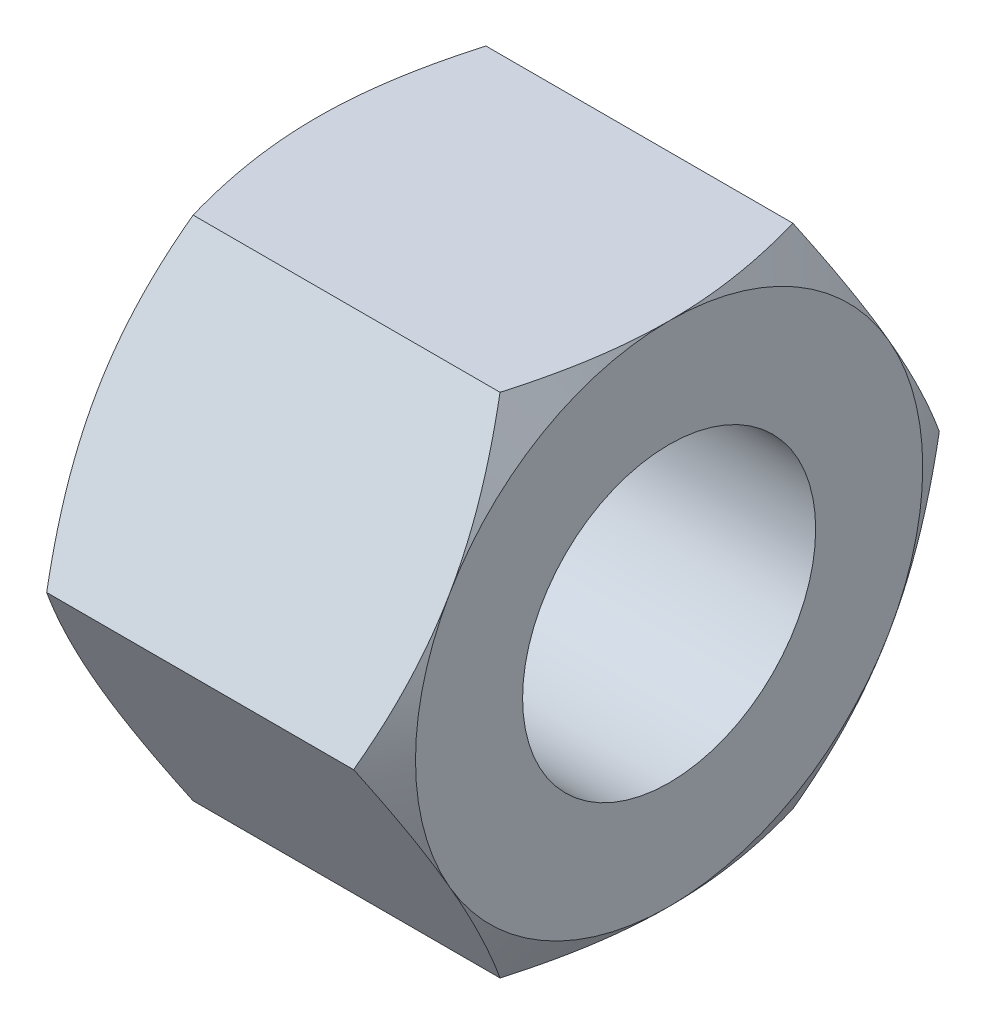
SolidWorks part; units mm, degrees
ref_plane "Plan1" through (0, 0, 0) normal (0, 0, 1) x (1, 0, 0)
ref_plane "Plan2" through (0, 0, 0) normal (0, 1, 0) x (1, 0, 0)
ref_plane "Plan3" through (0, 0, 0) normal (1, 0, 0) x (0, 0, -1)
sketch "Contour" plane through (0, 0, 0) normal (0, 0, 1) x (1, 0, 0)
  line L0 (-30, 0) -> (17.994, 0) construction
  line L1 (0, 10.4) -> (-25, 10.4)
  line L2 (0, 18) -> (-1.608, 20.7852)
  line L3 (0, 10.4) -> (0, 18)
  line L4 (-1.608, 20.7852) -> (-23.392, 20.7852)
  line L5 (-25, 18) -> (-25, 10.4)
  line L7 (-23.392, 20.7852) -> (-25, 18)
  dimension "D2" = 60
  dimension "d" = 20.8
  dimension "k" = 25
  dimension "D1" = 60
  dimension "s" = 36
  dimension "Dt" = 41.5704
revolve "Base-Révolution" add sketch "Contour" angle 360 about L0
sketch "H" plane through (-25, 0, 0) normal (-1, 0, 0) x (0, 0, 1)
  line L1 (20.7846, 0) -> (10.3923, 18)
  line L2 (10.3923, 18) -> (-10.3923, 18)
  line L3 (-10.3923, 18) -> (-20.7846, 0)
  line L4 (-20.7846, 0) -> (-10.3923, -18)
  line L5 (-10.3923, -18) -> (10.3923, -18)
  line L6 (10.3923, -18) -> (20.7846, 0)
  circle A0 centre (0, 0) radius 18 construction
  dimension "s1" = 36
extrude "Hexagone" cut sketch "H" against normal through all flip side to cut
equation "\"s1@H\" = \"s@Contour\""
equation "\"Dt@Contour\" = \"s@Contour\"/0.866"
